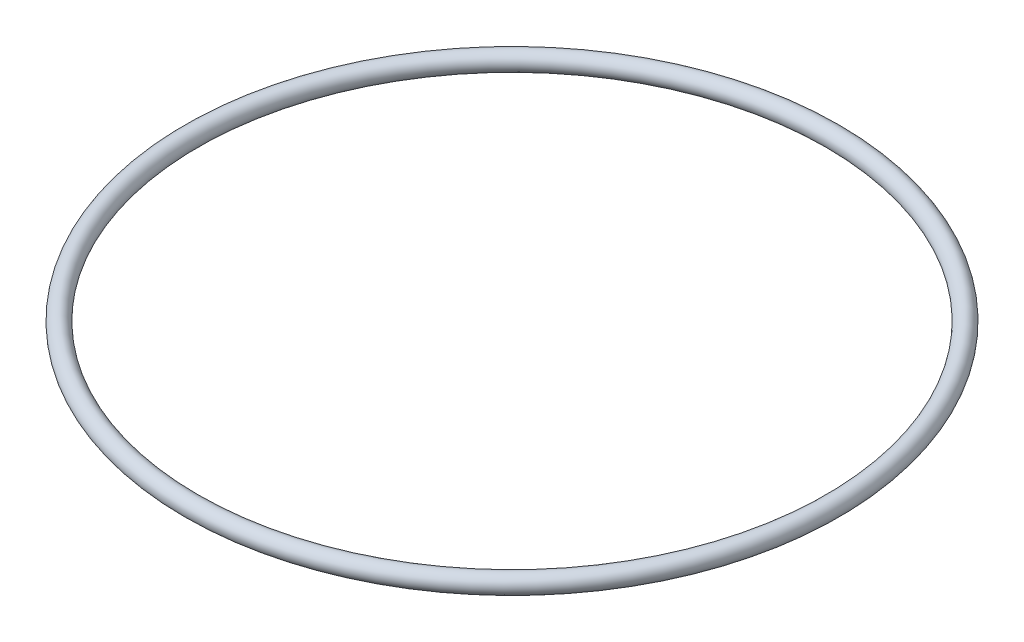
SolidWorks part; units mm, degrees
ref_plane "Plan1" through (0, 0, 0) normal (0, 0, 1) x (1, 0, 0)
ref_plane "Plan2" through (0, 0, 0) normal (0, 1, 0) x (1, 0, 0)
ref_plane "Plan3" through (0, 0, 0) normal (1, 0, 0) x (0, 0, -1)
sketch "Esquisse1" plane through (0, 0, 0) normal (0, 0, 1) x (1, 0, 0)
  line L1 (0, 0) -> (102, 0) construction
  line L2 (0, 1.5) -> (0, -1.5) construction
  circle A0 centre (52.5, 0) radius 1.5
  dimension "D2" = 52.5
  dimension "D1" = 3
  dimension "Diamètre du tore" = 3
  dimension "Diamètre intérieur" = 102
revolve "Base-Révolution" add sketch "Esquisse1" angle 360 about L2
equation " \"D1@Esquisse1\"=\"Diamètre du tore@Esquisse1\" "
equation "\"D2@Esquisse1\" = (\"Diamètre intérieur@Esquisse1\"/2)+(\"Diamètre du tore@Esquisse1\"/2)"
